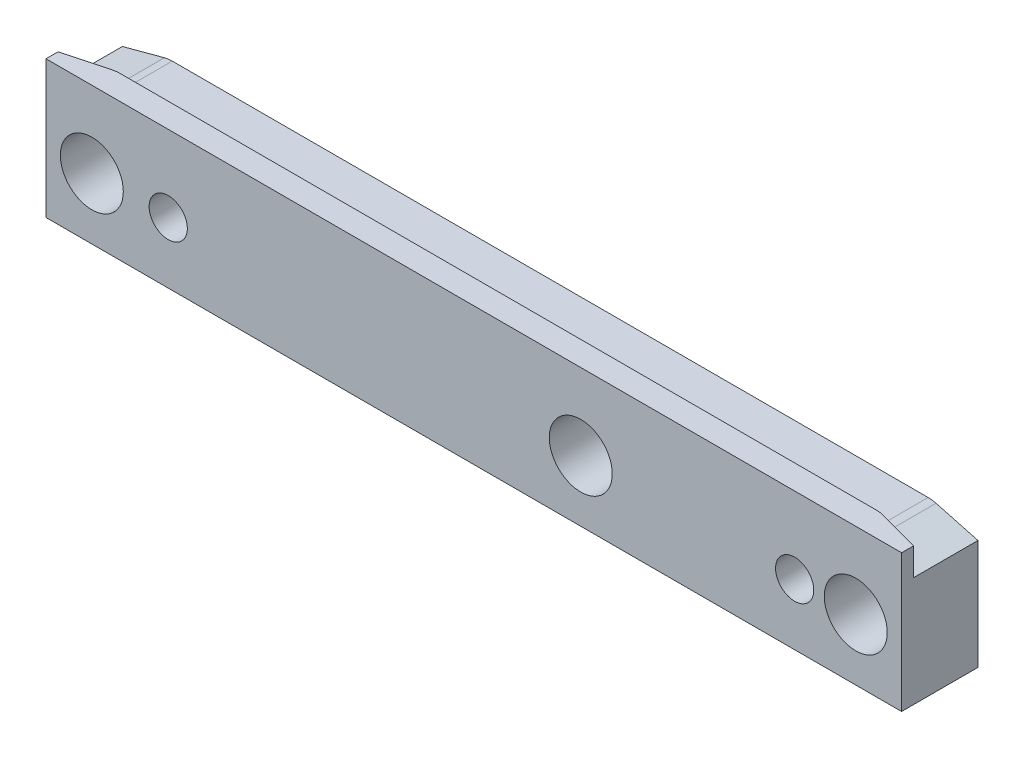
SolidWorks part; units mm, degrees
ref_plane "Front" through (0, 0, 0) normal (0, 0, 1) x (1, 0, 0)
ref_plane "Top" through (0, 0, 0) normal (0, 1, 0) x (1, 0, 0)
ref_plane "Right" through (0, 0, 0) normal (1, 0, 0) x (0, 0, -1)
sketch "Sketch1" plane through (0, 0, 0) normal (0, 0, 1) x (1, 0, 0)
  line L0 (-797.451, -76.5426) -> (-795.2892, -76.6445) construction
  line L1 (-978.101, -76.8985) -> (-1135.179, -76.8985)
  line L2 (-967.74, -79.4507) -> (-967.74, -102.2985)
  line L3 (-967.74, -102.2985) -> (-1145.54, -102.2985)
  line L4 (-1145.54, -79.4507) -> (-1145.54, -102.2985)
  line L5 (-745.49, -180.975) -> (-745.49, 149.225) construction
  line L6 (-967.74, -79.4507) -> (-976.4575, -77.1148)
  line L7 (-1136.8225, -77.1148) -> (-1145.54, -79.4507)
  line L9 (-797.451, -76.5426) -> (-795.2892, -76.6445) construction
  arc A0 (-1136.8225, -77.1148) -> (-1135.179, -76.8985) centre (-1135.179, -83.2485) cw
  arc A1 (-976.4575, -77.1148) -> (-978.101, -76.8985) centre (-978.101, -83.2485) ccw
  point P0 (-967.74, -76.8985)
  point P3 (-1145.54, -76.8985)
  point P14 (-1136.015, -76.8985)
  point P17 (-977.265, -76.8985)
  dimension "D9" = 6.35
  dimension "D1" = 222.25
  dimension "D2" = 177.8
  dimension "D3" = 25.4
  dimension "D4" = 0.254
  dimension "D5" = 9.525
  dimension "D6" = 15
  dimension "D7" = 9.525
  dimension "D8" = 15
extrude "Boss-Extrude1" add sketch "Sketch1" along normal blind 15.875 separate body
sketch "Sketch2" plane through (-967.74, 0, 0) normal (1, 0, 0) x (0, 0, -1)
  line L0 (-10.82, -81.661) -> (-10.82, -78.9217) construction
  line L1 (-10.82, -81.661) -> (-10.82, -78.9217) construction
  line L2 (-15.875, -76.8985) -> (0, -76.8985) construction
  line L3 (-15.875, -102.2985) -> (-10.82, -102.2985)
  line L4 (-15.875, -102.2985) -> (-15.875, -73.7235)
  line L5 (-15.875, -73.7235) -> (-10.82, -73.7235)
  line L6 (-10.82, -102.2985) -> (-10.82, -73.7235)
  dimension "D1" = 3.175
  dimension "D2" = 28.575
extrude "Boss-Extrude2" add sketch "Sketch2" against normal up to surface (177.8 mm away)
chamfer "Chamfer1" distance 9.525 angle 15 2 edges at (-1145.54, -76.5871, 10.82) (-967.74, -76.5871, 10.82)
fillet "Fillet1" radius 6.35 2 edges at (-1136.015, -75.3386, 10.82) (-977.265, -75.3386, 10.82)
sketch "Sketch3" plane through (0, 0, 15.875) normal (0, 0, 1) x (1, 0, 0)
  line L0 (-1145.54, -89.5985) -> (-967.74, -89.5985) construction
  line L1 (-1056.64, -98.4281) -> (-1056.64, -114.3031) construction
  line L2 (-1050.29, -98.4281) -> (-1050.29, -114.3031)
  line L3 (-1062.99, -98.4281) -> (-1062.99, -114.3031)
  line L4 (-1145.54, -79.4507) -> (-1145.54, -102.2985) construction
  line L5 (-967.74, -102.2985) -> (-967.74, -79.4507) construction
  line L6 (-1145.54, -102.2985) -> (-967.74, -102.2985) construction
  arc A0 (-1050.29, -98.4281) -> (-1062.99, -98.4281) centre (-1056.64, -98.4281) ccw
  arc A1 (-1062.99, -114.3031) -> (-1050.29, -114.3031) centre (-1056.64, -114.3031) ccw
  point P2 (-1136.015, -89.5985)
  point P3 (-1120.14, -89.5985)
  point P4 (-989.965, -89.5985)
  point P5 (-977.265, -89.5985)
  point P6 (-1056.64, -89.5985)
  point P9 (-1056.64, -106.3656)
  point P14 (-999.49, -89.5985)
  point P15 (-1110.615, -89.5985)
  dimension "D1" = 12.7
  dimension "D4" = 12.7
  dimension "D5" = 15.875
  dimension "D2" = 12.7
hole_wizard "Hole1" positions "Point_Sketch" profile "Profil_Sketch" hole size "Ø0.15" standard "ISO"
sketch "Point_Sketch" plane through (-1116.4857, -78.8475, 0) normal (0, 0, 1) x (-1, 0, 0)
  point P0 (3.6543, 10.7509)
  point P2 (-126.5207, 10.7509)
sketch "Profil_Sketch" plane through (-1120.14, -89.5985, 0) normal (1, 0, 0) x (0, 1, 0)
  line L0 (0, 0) -> (0, 15.875)
  line L1 (0, 15.875) -> (3.9687, 15.875)
  line L2 (3.9687, 15.875) -> (3.9687, 0)
  line L5 (3.9687, 0) -> (0, 0)
  line L11 (0, -6.35) -> (0, 107.95) construction
  dimension "Diameter" = 7.9375
  dimension "Thru Hole Depth" = 15.875
other "usin_DL090_.3125 x 1.25 DOWEL PIN<1>"
hole_wizard "Hole11" positions "Point_Sketch1" profile "Profil_Sketch1" counterbore size "1/4" standard "ANSI Inch"
sketch "Point_Sketch1" plane through (-1148.8841, -88.5137, 15.875) normal (0, 0, -1) x (1, 0, 0)
  point P0 (12.8691, 1.0848)
  point P2 (114.4691, 1.0848)
  point P4 (171.6191, 1.0848)
sketch "Profil_Sketch1" plane through (-1136.015, -89.5985, 15.875) normal (1, 0, 0) x (0, -1, 0)
  line L0 (0, 0) -> (0, 15.875)
  line L1 (0, 15.875) -> (4.3688, 15.875)
  line L3 (4.3688, 15.875) -> (4.3688, 9.652)
  line L4 (4.3688, 9.652) -> (6.5405, 9.652)
  line L5 (6.5405, 9.652) -> (6.5405, 0)
  line L7 (6.5405, 0) -> (0, 0)
  line L11 (0, -6.35) -> (0, 107.95) construction
  dimension "Diameter" = 8.7376
  dimension "Thru Hole Depth" = 15.875
  dimension "L1" = 9.652
other "usin_LS160_.3125-18x.75-SHCS<1>"
